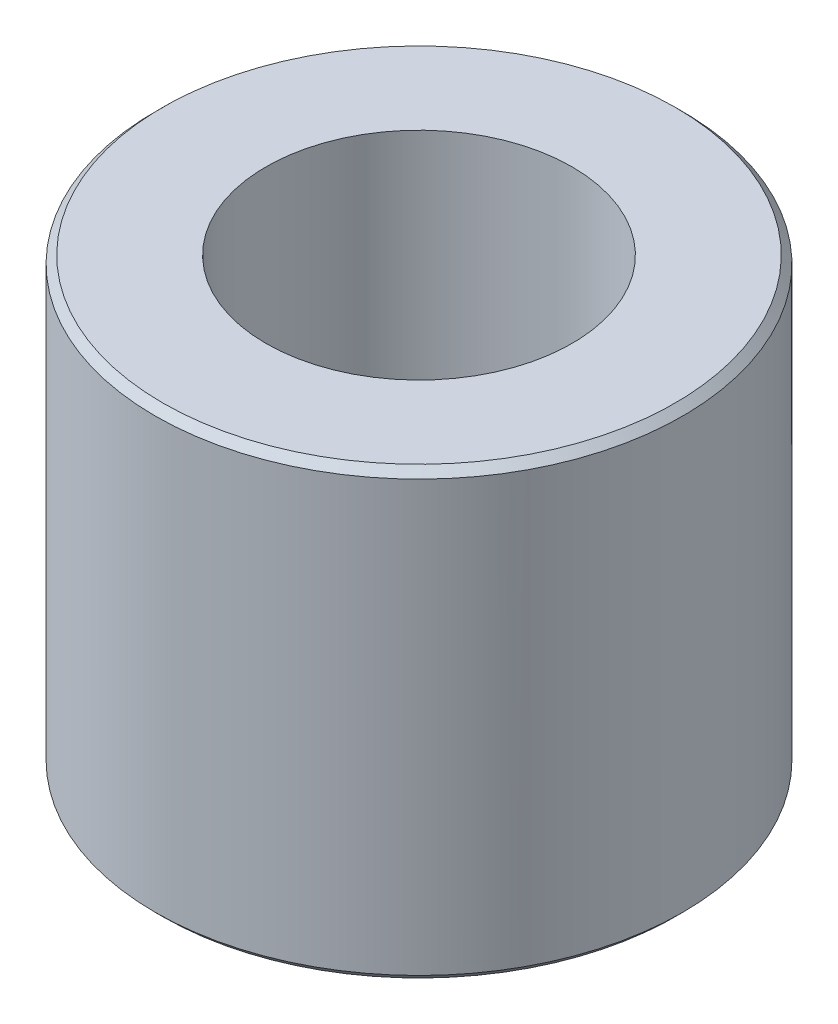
SolidWorks part; units mm, degrees
ref_plane "Front Plane" through (0, 0, 0) normal (0, 0, 1) x (1, 0, 0)
ref_plane "Top Plane" through (0, 0, 0) normal (0, 1, 0) x (1, 0, 0)
ref_plane "Right Plane" through (0, 0, 0) normal (1, 0, 0) x (0, 0, -1)
sketch "Sketch1" plane through (0, 0, 0) normal (0, 0, 1) x (1, 0, 0)
  line L0 (0, 12.4902) -> (0, -31.8413) construction
  line L1 (0, 0) -> (-17.78, 0)
  line L2 (0, 0) -> (0, -29.9974)
  line L3 (0, -29.9974) -> (-17.78, -29.9974)
  line L4 (-17.78, 0) -> (-17.78, -29.9974)
  dimension "D1" = 35.56
  dimension "D2" = 29.9974
revolve "Revolve1" add sketch "Sketch1" angle 360 about L0
hole_wizard "7/8-20 Tapped Hole1" positions "Sketch3" profile "Sketch2" tap size "7/8-14" standard "ANSI Inch"
sketch "Sketch3" plane through (0, 0, 0) normal (0, 1, 0) x (1, 0, 0)
  point P0 (0, 0)
sketch "Sketch2" plane through (0, 0, 0) normal (1, 0, 0) x (0, 0, 1)
  line L0 (0, 0) -> (0, 59.7179)
  line L1 (0, 59.7179) -> (10.3187, 53.5178)
  line L2 (10.3187, 53.5178) -> (10.3187, 0)
  line L5 (10.3187, 0) -> (0, 0)
  line L10 (0, 59.7179) -> (-10.3188, 53.5178) construction
  line L11 (0, -6.35) -> (0, 107.95) construction
  dimension "Tap Drill Dia." = 20.6375
  dimension "Tap Drill Depth" = 53.5178
  dimension "Drill Angle" = 118
sketch "Sketch4" plane through (0, 0, 0) normal (0, 0, 1) x (1, 0, 0)
  line L0 (-11.1125, -29.9974) -> (-11.1125, -16.0274)
  line L1 (-17.78, -29.9974) -> (17.78, -29.9974) construction
  line L2 (-11.1125, -16.0274) -> (0, -9.3503)
  line L3 (0, -9.3503) -> (0, -29.9974)
  line L4 (0, -29.9974) -> (-11.1125, -29.9974)
  line L5 (0, 4.8636) -> (0, -30.7737) construction
  line L6 (17.78, 0) -> (-17.78, 0) construction
  dimension "D1" = 22.225
  dimension "D2" = 13.97
  dimension "D3" = 59
  dimension "D4" = 16.0274
revolve "Cut-Revolve1" cut sketch "Sketch4" angle 360 about L5
chamfer "Chamfer1" distance 1.651 angle 45 1 edges at (0, -29.9974, 11.1125)
sketch "Sketch5" plane through (0, -29.9974, 0) normal (0, -1, 0) x (1, 0, 0)
  line L1 (12.8316, 0) -> (6.4158, 11.1125)
  line L2 (6.4158, 11.1125) -> (-6.4158, 11.1125)
  line L3 (-6.4158, 11.1125) -> (-12.8316, 0)
  line L4 (-12.8316, 0) -> (-6.4158, -11.1125)
  line L5 (-6.4158, -11.1125) -> (6.4158, -11.1125)
  line L6 (6.4158, -11.1125) -> (12.8316, 0)
  circle A0 centre (0, 0) radius 11.1125 construction
  circle A2 centre (0, 0) radius 11.1125 construction
extrude "Cut-Extrude1" cut sketch "Sketch5" against normal blind 12.7
chamfer "Chamfer2" distance 0.508 angle 45 2 edges at (0, -29.9974, 17.78) (0, 0, 17.78)
